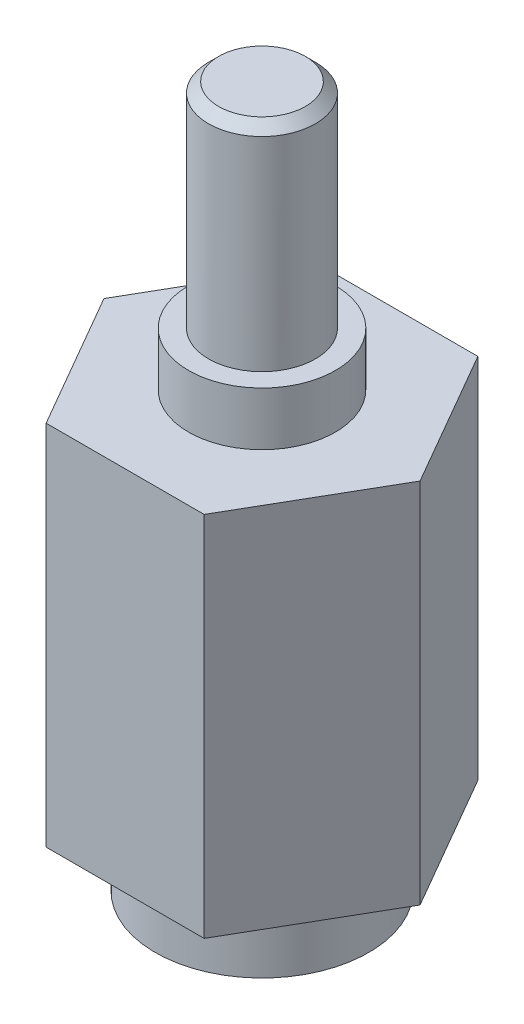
SolidWorks part; units mm, degrees
ref_plane "Plan de face" through (0, 0, 0) normal (0, 0, 1) x (1, 0, 0)
ref_plane "Plan de dessus" through (0, 0, 0) normal (0, 1, 0) x (1, 0, 0)
ref_plane "Plan de droite" through (0, 0, 0) normal (1, 0, 0) x (0, 0, -1)
sketch "Esquisse1" plane through (0, 0, 0) normal (0, 0, 1) x (1, 0, 0)
  line L0 (0, 0) -> (16, 0)
  line L1 (16, 0) -> (16, 10)
  line L2 (16, 10) -> (20, 10)
  line L3 (20, 10) -> (20, 65)
  line L6 (20, 65) -> (11, 65)
  line L8 (11, 65) -> (11, 73)
  line L9 (11, 73) -> (8, 73)
  line L10 (8, 73) -> (8, 105)
  line L11 (8, 105) -> (0, 105)
  line L12 (0, 105) -> (0, 0)
  dimension "D1" = 105
  dimension "D2" = 8
  dimension "D3" = 11
  dimension "D4" = 20
  dimension "D5" = 16
  dimension "D6" = 10
  dimension "D7" = 8
  dimension "D8" = 55
revolve "Révolution4" add sketch "Esquisse1" angle 360 about L12
hole_wizard "Trou taraudé M16x1.52" positions "Esquisse6" profile "Esquisse5" tap size "M16x1.5" standard "DIN"
sketch "Esquisse6" plane through (0, 0, 0) normal (0, -1, 0) x (1, 0, 0)
  point P0 (0, 0)
sketch "Esquisse5" plane through (0, 0, 0) normal (1, 0, 0) x (0, 0, -1)
  line L0 (0, 0) -> (0, 43.8562)
  line L1 (0, 43.8562) -> (7.25, 39.5)
  line L2 (7.25, 39.5) -> (7.25, 0)
  line L5 (7.25, 0) -> (0, 0)
  line L10 (0, 43.8562) -> (-7.25, 39.5) construction
  line L11 (0, -6.35) -> (0, 107.95) construction
  dimension "Diamètre du trou pour taraudage" = 14.5
  dimension "Profondeur du trou pour taraudage" = 39.5
  dimension "Angle de pointe" = 118
sketch "Esquisse7" plane through (0, 65, 0) normal (0, 1, 0) x (1, 0, 0)
  line L0 (-11.8357, 20.5) -> (11.8357, 20.5)
  line L1 (-23.6714, 0) -> (-11.8357, 20.5)
  line L2 (-11.8357, -20.5) -> (-23.6714, 0)
  line L3 (11.8357, -20.5) -> (-11.8357, -20.5)
  line L4 (23.6714, 0) -> (11.8357, -20.5)
  line L5 (11.8357, 20.5) -> (23.6714, 0)
  dimension "D1" = 41
  dimension "D2" = 41
  dimension "D3" = 41
  dimension "D4" = 20.5
  dimension "D5" = 20.5
  dimension "D6" = 20.5
  dimension "D7" = 20.5
extrude "Extrusion1" add sketch "Esquisse7" against normal blind 55
chamfer "Chanfrein1" distance 1.5 angle 45
